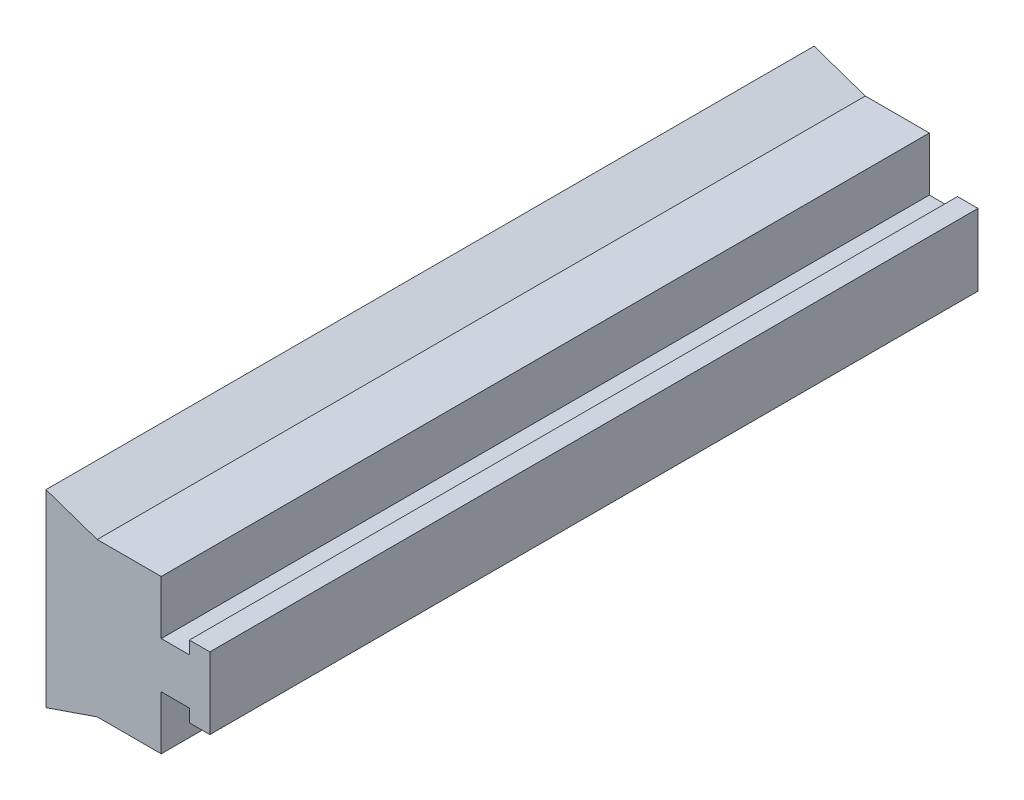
SolidWorks part; units mm, degrees
ref_plane "Front Plane" through (0, 0, 0) normal (0, 0, 1) x (1, 0, 0)
ref_plane "Top Plane" through (0, 0, 0) normal (0, 1, 0) x (1, 0, 0)
ref_plane "Right Plane" through (0, 0, 0) normal (1, 0, 0) x (0, 0, -1)
sketch "Sketch1" plane through (0, 0, 0) normal (0, 0, 1) x (1, 0, 0)
  line L0 (6.5, 0) -> (-6.5, 0) construction
  line L5 (-6.5, -7.375) -> (-6.5, 7.375)
  line L7 (2.5, 6) -> (2.5, 1.8)
  line L8 (2.5, 1.8) -> (4.7, 1.8)
  line L9 (4.7, 1.8) -> (4.7, 2.8)
  line L10 (4.7, 2.8) -> (6.3, 2.8)
  line L11 (6.3, 2.8) -> (6.3, 0)
  line L12 (6.5, 0) -> (6.5, 3) construction
  line L13 (6.5, 3) -> (4.5, 3) construction
  line L14 (4.5, 3) -> (4.5, 2) construction
  line L15 (4.5, 2) -> (2.5, 2) construction
  line L16 (3.5, 2) -> (3.5, 1.8) construction
  line L17 (5.5, 2.8) -> (5.5, 3) construction
  line L18 (6.3, 1.4) -> (6.5, 1.4) construction
  line L19 (4.7, 2.8) -> (4.5, 2.8) construction
  line L20 (6.3, -2.8) -> (6.3, 0)
  line L21 (4.7, -2.8) -> (6.3, -2.8)
  line L22 (4.7, -1.8) -> (4.7, -2.8)
  line L23 (2.5, -6) -> (2.5, -1.8)
  line L24 (2.5, -1.8) -> (4.7, -1.8)
  line L26 (2.5, 6) -> (-2.5, 6)
  line L27 (-2.5, 6) -> (-6.5, 7.375)
  line L28 (2.5, -6) -> (-2.5, -6)
  line L29 (-2.5, -6) -> (-6.5, -7.375)
  point P3 (0, 0)
  point P9 (-6.5, 0)
  dimension "D1" = 13
  dimension "D2" = 14.75
  dimension "D3" = 9
  dimension "D4" = 0.2
  dimension "D5" = 2
  dimension "D6" = 1
  dimension "D7" = 3
  dimension "D8" = 12
  dimension "D9" = 5
extrude "Boss-Extrude1" add sketch "Sketch1" along normal mid plane 60
